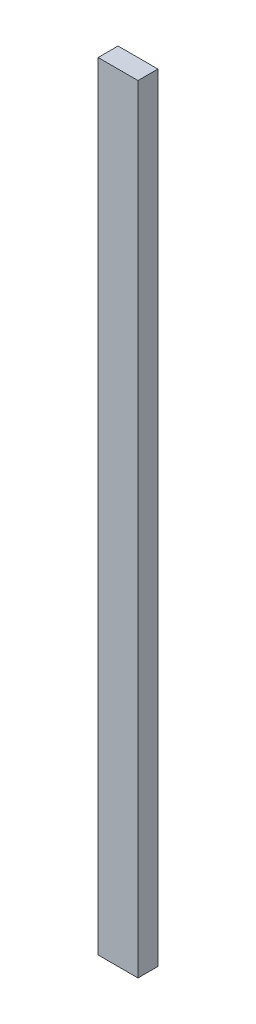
SolidWorks part; units mm, degrees
ref_plane "Front Plane" through (0, 0, 0) normal (0, 0, 1) x (1, 0, 0)
ref_plane "Top Plane" through (0, 0, 0) normal (0, 1, 0) x (1, 0, 0)
ref_plane "Right Plane" through (0, 0, 0) normal (1, 0, 0) x (0, 0, -1)
sketch "Sketch1" plane through (0, 0, 0) normal (0, 1, 0) x (1, 0, 0)
  line L1 (-50.8, 25.4) -> (50.8, 25.4)
  line L2 (-50.8, 25.4) -> (-50.8, -25.4)
  line L3 (-50.8, -25.4) -> (50.8, -25.4)
  line L4 (50.8, 25.4) -> (50.8, -25.4)
  line L5 (-50.8, 25.4) -> (50.8, -25.4) construction
  line L6 (-50.8, -25.4) -> (50.8, 25.4) construction
  point P0 (0, 0)
  dimension "D1" = 50.8
  dimension "D2" = 101.6
extrude "Boss-Extrude1" add sketch "Sketch1" along normal blind 1981.2
